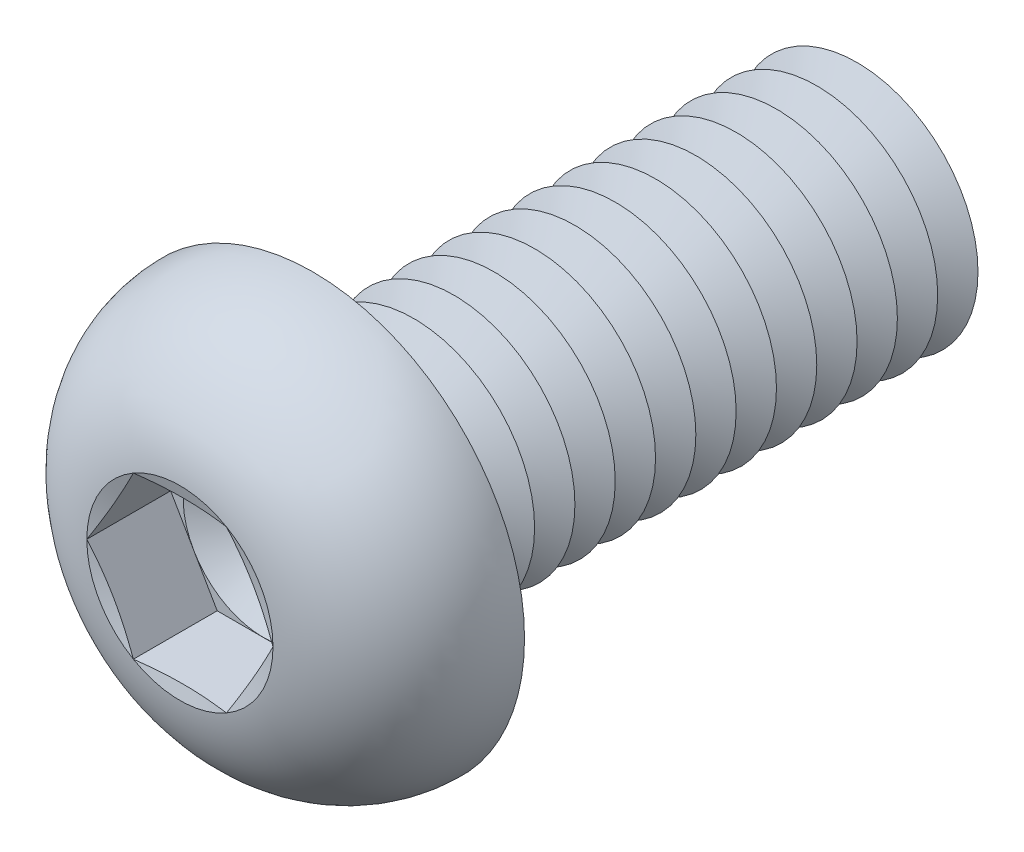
SolidWorks part; units mm, degrees
ref_plane "Front Plane" through (0, 0, 0) normal (0, 0, 1) x (1, 0, 0)
ref_plane "Top Plane" through (0, 0, 0) normal (0, 1, 0) x (1, 0, 0)
ref_plane "Right Plane" through (0, 0, 0) normal (1, 0, 0) x (0, 0, -1)
sketch "Sketch1" plane through (0, 0, 0) normal (1, 0, 0) x (0, 0, -1)
  line L0 (0, 3) -> (0, 5.25)
  line L3 (0, 3) -> (14, 3)
  line L4 (14, 3) -> (14, 0)
  line L5 (14, 0) -> (-3.3, 0) construction
  line L6 (-3.3, 0) -> (14, 0)
  line L7 (-3.3, 2.3094) -> (-3.3, 1.1547) construction
  line L8 (-3.3, 1.1547) -> (-3.3, 0)
  line L9 (-3.3, 2.3094) -> (-2.9906, 1.1547)
  line L10 (-2.9906, 1.1547) -> (-3.3, 1.1547)
  line L11 (14, 0) -> (22.7481, 0) construction
  line L12 (0, 5.25) -> (-3.3, 5.25) construction
  arc A1 (0, 5.25) -> (-3.3, 2.3094) centre (0, 1.928) ccw
  point P8 (14, 1.5)
  dimension "D1" = 10.5
  dimension "D2" = 6
  dimension "D3" = 3.3
  dimension "D4" = 4.6188
  dimension "D5" = 14
  dimension "D6" = 15
revolve "Revolve1" add sketch "Sketch1" angle 360 about L5
fillet "Fillet1" radius 0.5 1 edges at (-3, 0, 0)
sketch "Sketch2" plane through (0, 0, 0) normal (1, 0, 0) x (0, 0, -1)
  line L0 (13.5, 3) -> (14.5, 3)
  line L1 (14, 3) -> (0.5, 3) construction
  line L2 (14.5, 3) -> (14, 2.134)
  line L3 (14, -3) -> (14, 3) construction
  line L4 (14, 2.134) -> (13.5, 3)
  dimension "D1" = 1
revolve "Cut-Revolve1" cut sketch "Sketch2" angle 360 about axis through (0, 0, -14) along (0, 0, -1)
pattern_linear "LPattern1" count 14 spacing 1 along (0, 0, 1) of "Cut-Revolve1"
sketch "Sketch3" plane through (0, 0, 3.3) normal (0, 0, 1) x (1, 0, 0)
  line L7 (1.1547, 2) -> (-1.1547, 2)
  line L8 (-1.1547, 2) -> (-2.3094, 0)
  line L9 (-2.3094, 0) -> (-1.1547, -2)
  line L10 (-1.1547, -2) -> (1.1547, -2)
  line L11 (1.1547, -2) -> (2.3094, 0)
  line L12 (2.3094, 0) -> (1.1547, 2)
  circle A0 centre (0, 0) radius 2 construction
  circle A3 centre (0, 0) radius 2.3094 construction
extrude "Cut-Extrude1" cut sketch "Sketch3" against normal blind 2.08
sketch "Sketch4" plane through (0, 0, 1.22) normal (0, 0, 1) x (1, 0, 0)
  line L1 (1.1547, 2) -> (-1.1547, 2) construction
  circle A0 centre (0, 0) radius 2
extrude "Cut-Extrude2" cut sketch "Sketch4" against normal through all draft 60
